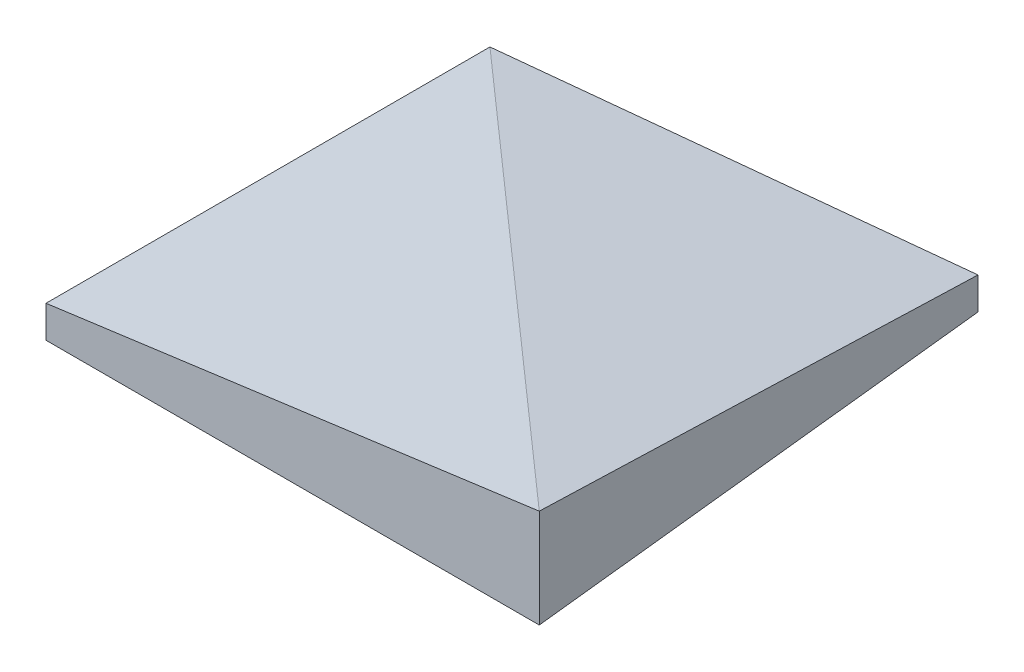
SolidWorks part; units mm, degrees
ref_plane "Front Plane" through (0, 0, 0) normal (0, 0, 1) x (1, 0, 0)
ref_plane "Top Plane" through (0, 0, 0) normal (0, 1, 0) x (1, 0, 0)
ref_plane "Right Plane" through (0, 0, 0) normal (1, 0, 0) x (0, 0, -1)
sketch "Sketch1" plane through (0, 0, 0) normal (0, 1, 0) x (1, 0, 0)
  line L0 (-1000, 900) -> (1000, -900)
  line L1 (-1000, 900) -> (1000, 900)
  line L2 (-1000, 900) -> (-1000, -900)
  line L3 (-1000, -900) -> (1000, -900)
  line L4 (1000, 900) -> (1000, -900)
  line L5 (-1000, 900) -> (1000, -900) construction
  line L6 (-1000, -900) -> (1000, 900) construction
  point P0 (0, 0)
  dimension "D1" = 1800
  dimension "D2" = 2000
extrude "Boss-Extrude1" add sketch "Sketch1" along normal blind 400 contours L2 L3 L0
sketch "Sketch2" plane through (0, 0, 900) normal (0, 0, 1) x (1, 0, 0)
  line L0 (1000, 400) -> (-1000, 130)
  line L1 (-1000, 400) -> (-1000, 0) construction
  line L2 (-1000, 0) -> (1000, 0) construction
  dimension "D1" = 130
extrude "Cut-Extrude1" cut sketch "Sketch2" against normal through all both and the other way through all flip side to cut
mirror "Mirror1" about plane through (0, 400, 0) normal (0.669, 0, -0.7433)
